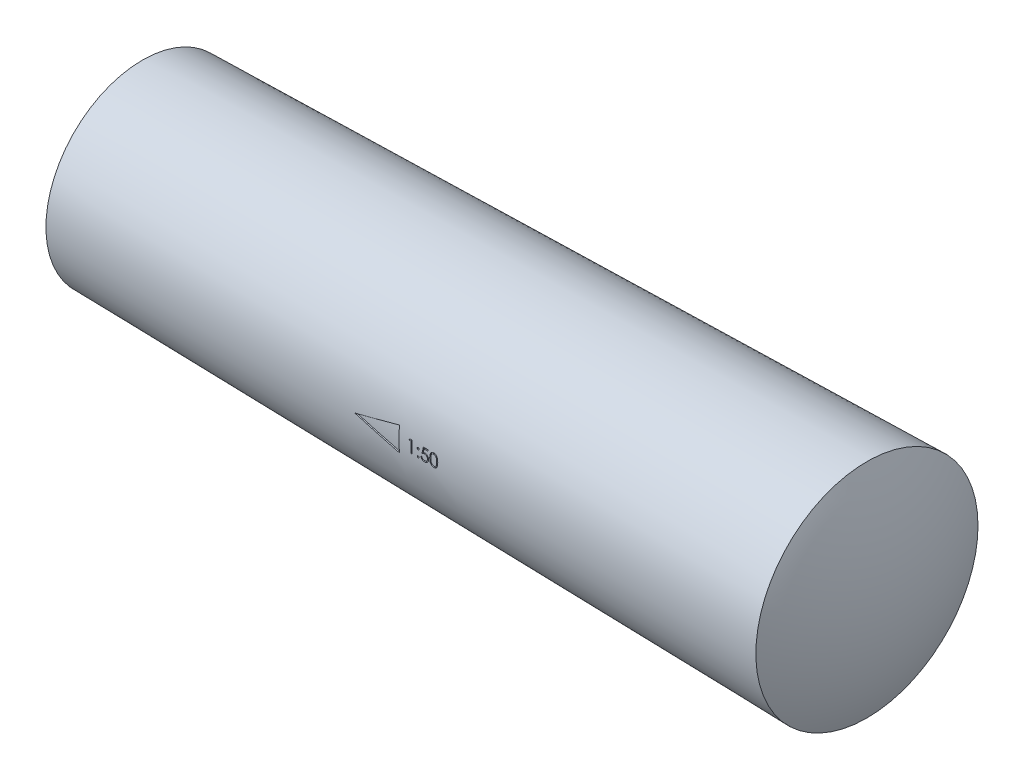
SolidWorks part; units mm, degrees
ref_plane "Front Plane" through (0, 0, 0) normal (0, 0, 1) x (1, 0, 0)
ref_plane "Top Plane" through (0, 0, 0) normal (0, 1, 0) x (1, 0, 0)
ref_plane "Right Plane" through (0, 0, 0) normal (1, 0, 0) x (0, 0, -1)
sketch "Sketch1" plane through (0, 0, 0) normal (1, 0, 0) x (0, 0, -1)
  circle A0 centre (0, 0) radius 8
  dimension "D1" = 16
extrude "Extrude1" add sketch "Sketch1" along normal mid plane 60
draft "Draft1" type of draft neutral plane draft angle 1.146 faces to draft 1 parameters "D1"=1.146
sketch "Sketch2" plane through (0, 0, 0) normal (0, 0, 1) x (1, 0, 0)
  line L0 (-30, 0) -> (-30, 8)
  line L1 (-30, 8) -> (-30, -8) construction
  line L2 (-30, 0) -> (-32, 0)
  line L3 (-32, 0) -> (-32, -8.6) construction
  line L4 (30, 0) -> (30, 9.2)
  line L5 (30, -9.2) -> (30, 9.2) construction
  line L6 (30, 0) -> (32, 0)
  line L7 (32, 0) -> (32, -8.6) construction
  line L8 (-30, -8) -> (30, -9.2) construction
  arc A0 (-32, 0) -> (-30, 8) centre (-15, 0) cw
  arc A1 (32, 0) -> (30, 9.2) centre (9.8398, 0) ccw
  point P14 (0, -8.6)
revolve "Revolve1" add sketch "Sketch2" angle 360 about L2
sketch "Sketch5" plane through (0, 0, 0) normal (0, 0, 1) x (1, 0, 0)
  line L0 (0, 8.6) -> (0, -8.6) construction
  line L1 (30, 9.2) -> (-30, 8) construction
  line L2 (-30, -8) -> (30, -9.2) construction
ref_plane "Plane2" through (0, 0, 0) normal (-0.02, 0, 0.9998) x (0.9998, 0, 0.02)
sketch "Sketch6" plane through (0, 0, 0) normal (-0.02, 0, 0.9998) x (0.9998, 0, 0.02)
  line L0 (0, 0) -> (0, 1)
  line L1 (0, 8.6) -> (0, -8.6) construction
  line L2 (0, 1) -> (-3.7321, 0)
  line L3 (-3.7321, 0) -> (0, -1)
  line L4 (0, -1) -> (0, 0)
  line L5 (0, -0.5) -> (4, -0.5) construction
  text T0 "1:50" font "Century Gothic" height 1
  dimension "D1" = 2
  dimension "D2" = 30
  dimension "D3" = 4
wrap "Wrap2" sketch "Sketch6" wrap type deboss source sketch "Sketch6" thickness 0.1 parameters "D1"=0.1
equation "\"D2@Sketch2\" = \"D1@Sketch2\""
